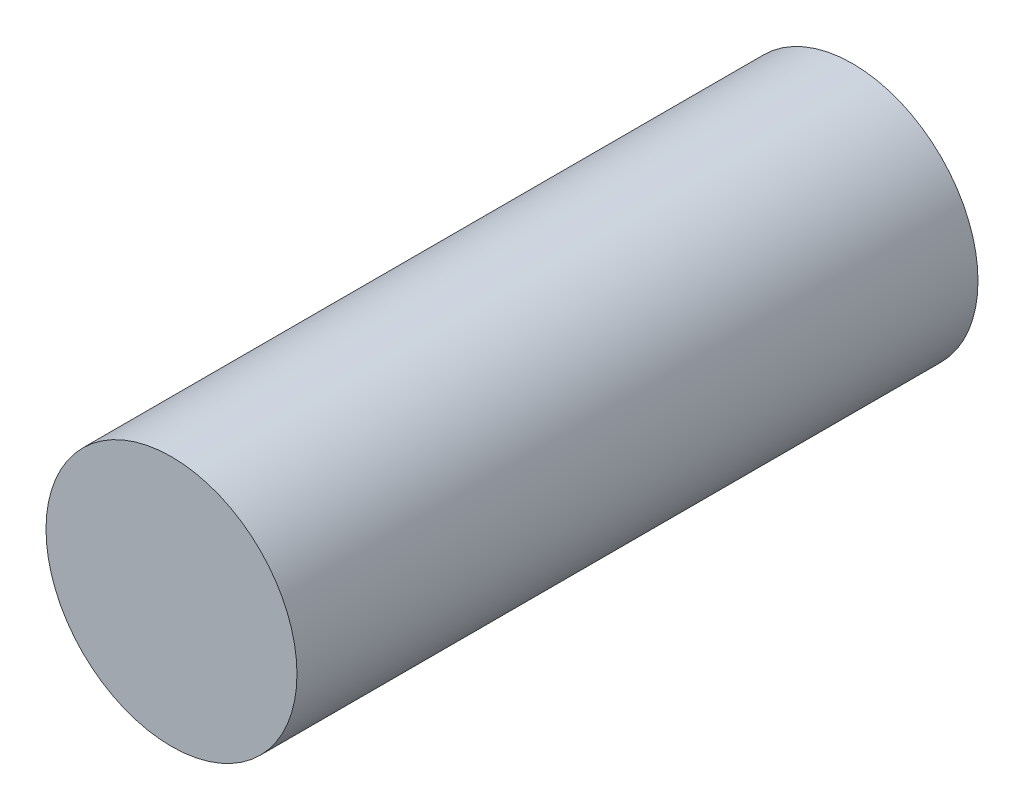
SolidWorks part; units mm, degrees
ref_plane "Front Plane" through (0, 0, 0) normal (0, 0, 1) x (1, 0, 0)
ref_plane "Top Plane" through (0, 0, 0) normal (0, 1, 0) x (1, 0, 0)
ref_plane "Right Plane" through (0, 0, 0) normal (1, 0, 0) x (0, 0, -1)
ref_plane "Plane1" through (0, 45.3626, 0) normal (0, -1, 0) x (1, 0, 0)
sketch "Sketch1" plane through (0, 45.3626, 0) normal (0, -1, 0) x (1, 0, 0)
  line L0 (39.2222, 570) -> (-65.8068, 570)
  line L1 (-65.8068, 570) -> (-65.8068, 0)
  line L2 (-65.8068, 0) -> (39.2222, 0)
  line L3 (39.2222, 0) -> (39.2222, 570)
  line L4 (-65.8068, 570) -> (-65.8068, 0) construction
revolve "Revolve1" add sketch "Sketch1" angle 360 about L4
